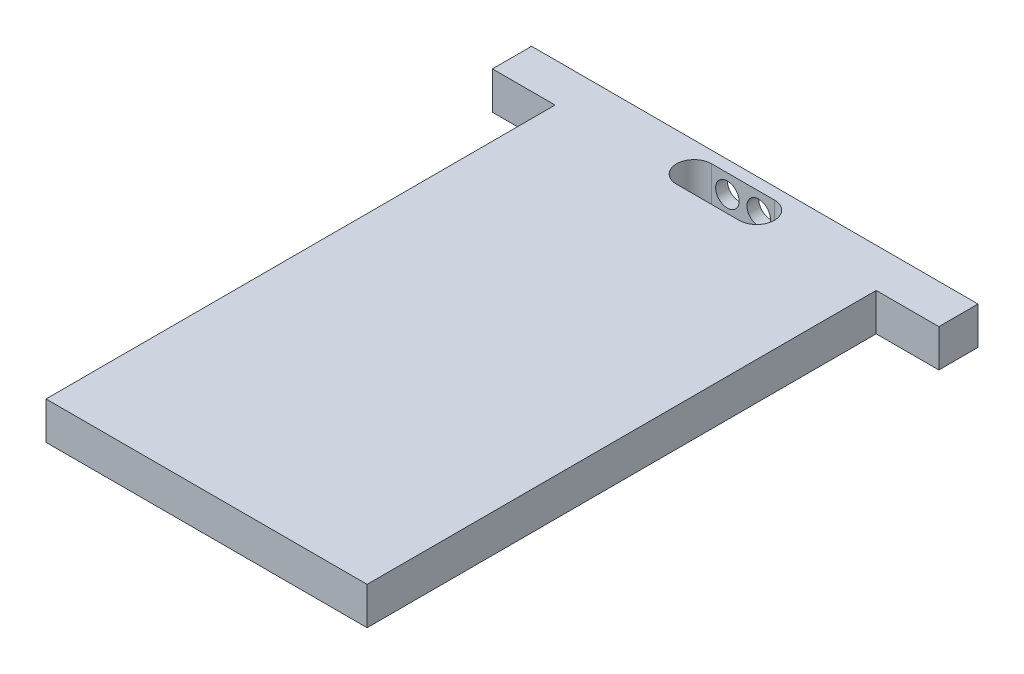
SolidWorks part; units mm, degrees
ref_plane "Front Plane" through (0, 0, 0) normal (0, 0, 1) x (1, 0, 0)
ref_plane "Top Plane" through (0, 0, 0) normal (0, 1, 0) x (1, 0, 0)
ref_plane "Right Plane" through (0, 0, 0) normal (1, 0, 0) x (0, 0, -1)
sketch "Sketch1" plane through (0, 0, 0) normal (0, 0, 1) x (1, 0, 0)
  line L1 (-20.5, -2.4) -> (20.5, -2.4)
  line L2 (-20.5, -2.4) -> (-20.5, 2.4)
  line L3 (-20.5, 2.4) -> (20.5, 2.4)
  line L4 (20.5, -2.4) -> (20.5, 2.4)
  line L5 (-20.5, -2.4) -> (20.5, 2.4) construction
  line L6 (-20.5, 2.4) -> (20.5, -2.4) construction
  point P0 (0, 0)
  dimension "D1" = 41
  dimension "D2" = 4.8
extrude "Boss-Extrude1" add sketch "Sketch1" along normal mid plane 65
sketch "Sketch2" plane through (0, 0, -32.5) normal (0, 0, 1) x (1, 0, 0)
  line L0 (20.5, -2.4) -> (20.5, 2.4) construction
  line L1 (-28.5, -2.4) -> (28.5, -2.4)
  line L2 (-28.5, -2.4) -> (-28.5, 2.4)
  line L3 (-28.5, 2.4) -> (28.5, 2.4)
  line L4 (28.5, -2.4) -> (28.5, 2.4)
  line L5 (-28.5, -2.4) -> (28.5, 2.4) construction
  line L6 (-28.5, 2.4) -> (28.5, -2.4) construction
  line L7 (0, 0) -> (0, -7.2336) construction
  dimension "D1" = 4.8
  dimension "D2" = 8
extrude "Boss-Extrude2" add sketch "Sketch2" against normal blind 5
sketch "Sketch3" plane through (0, 2.4, 0) normal (0, 1, 0) x (1, 0, 0)
  line L1 (28.5, 37.5) -> (-28.5, 37.5) construction
  line L2 (-4, 33.75) -> (4, 33.75) construction
  line L3 (-4, 36) -> (4, 36)
  line L4 (-4, 31.5) -> (4, 31.5)
  arc A1 (-4, 36) -> (-4, 31.5) centre (-4, 33.75) ccw
  arc A2 (4, 31.5) -> (4, 36) centre (4, 33.75) ccw
  circle A3 centre (0, 37.5) radius 2.5 construction
  point P0 (0, 33.75)
  point P1 (0, 33.75)
  point P4 (0, 37.5)
  dimension "D1" = 3.75
  dimension "D2" = 4.5
  dimension "D4" = 5
  dimension "D3" = 8
extrude "Cut-Extrude1" cut sketch "Sketch3" against normal through all
sketch "Sketch4" plane through (0, 0, -37.5) normal (0, 0, -1) x (-1, 0, 0)
  line L0 (0, 0) -> (0, 2.2954) construction
  circle A1 centre (2, 0) radius 1.5
  circle A2 centre (-2, 0) radius 1.5
  dimension "D1" = 3
  dimension "D2" = 2
extrude "Cut-Extrude2" cut sketch "Sketch4" against normal up to next
